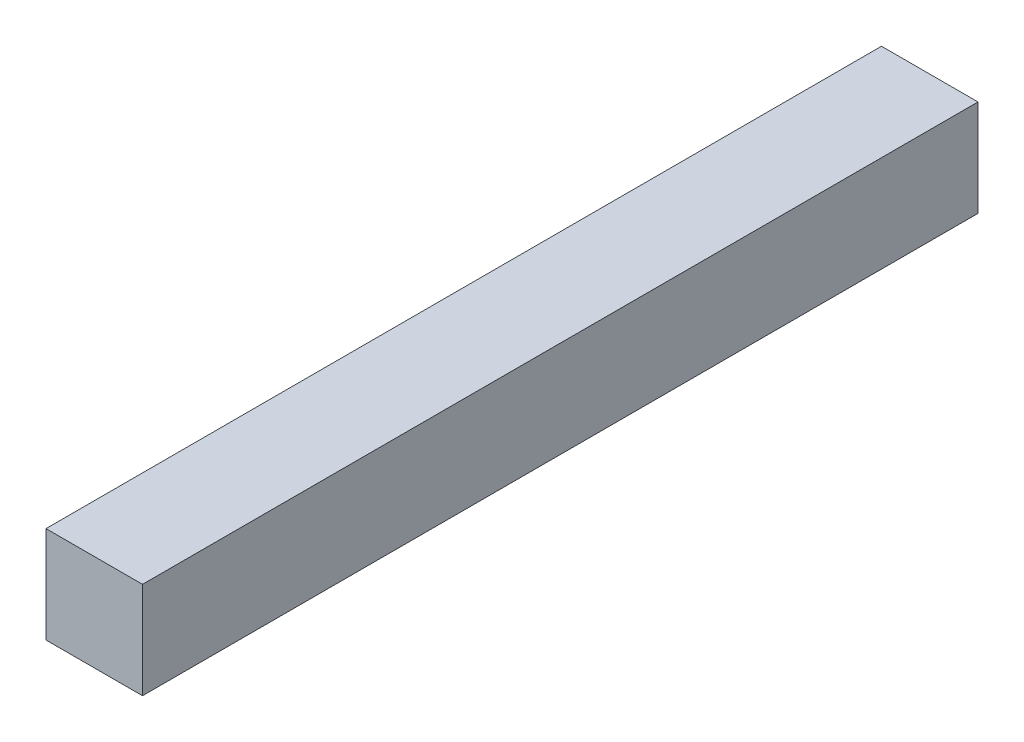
SolidWorks part; units mm, degrees
ref_plane "Plan de face" through (0, 0, 0) normal (0, 0, 1) x (1, 0, 0)
ref_plane "Plan de dessus" through (0, 0, 0) normal (0, 1, 0) x (1, 0, 0)
ref_plane "Plan de droite" through (0, 0, 0) normal (1, 0, 0) x (0, 0, -1)
sketch "Esquisse1" plane through (0, 0, 0) normal (0, 0, 1) x (1, 0, 0)
  line L1 (-33.5, 33.5) -> (33.5, 33.5)
  line L2 (-33.5, 33.5) -> (-33.5, -33.5)
  line L3 (-33.5, -33.5) -> (33.5, -33.5)
  line L4 (33.5, 33.5) -> (33.5, -33.5)
  line L5 (-33.5, 33.5) -> (33.5, -33.5) construction
  line L6 (-33.5, -33.5) -> (33.5, 33.5) construction
  point P0 (0, 0)
  dimension "D1" = 67
  dimension "D2" = 67
extrude "Boss.-Extru.1" add sketch "Esquisse1" along normal blind 580
